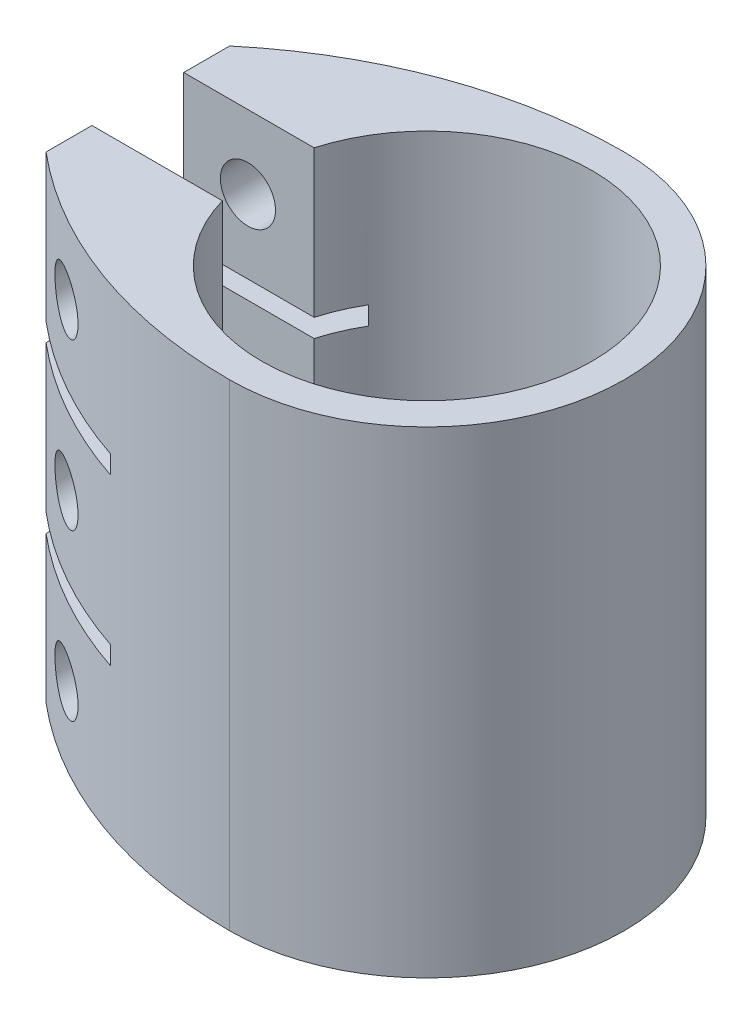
SolidWorks part; units mm, degrees
ref_plane "Alzado" through (0, 0, 0) normal (0, 0, 1) x (1, 0, 0)
ref_plane "Planta" through (0, 0, 0) normal (0, 1, 0) x (1, 0, 0)
ref_plane "Vista lateral" through (0, 0, 0) normal (1, 0, 0) x (0, 0, -1)
sketch "Croquis1" plane through (0, 0, 0) normal (0, 1, 0) x (1, 0, 0)
  line L0 (0, 21.5) -> (46.284, 21.5) construction
  line L1 (-31.5, 10) -> (-31.5, 5)
  line L2 (-31.5, 5) -> (-17.2916, 5)
  line L3 (0, 0) -> (-31.5, 0) construction
  line L4 (-31.5, 0) -> (-31.5, 5) construction
  line L5 (-31.5, -10) -> (-31.5, -5)
  line L6 (-31.5, -5) -> (-17.2916, -5)
  arc A0 (-17.2916, -5) -> (-17.2916, 5) centre (0, 0) ccw
  arc A1 (0, -21.5) -> (0, 21.5) centre (0, 0) ccw
  arc A2 (0, 21.5) -> (-31.5, 10) centre (0, -27.3913) ccw
  arc A3 (0, -21.5) -> (-31.5, -10) centre (0, 27.3913) cw
  point P11 (21.5, 0)
  dimension "D1" = 43
  dimension "D2" = 36
  dimension "D3" = 53
  dimension "D4" = 5
  dimension "D5" = 5
extrude "Saliente-Extruir1" add sketch "Croquis1" along normal blind 52
sketch "Croquis2" plane through (0, 0, 0) normal (0, 0, 1) x (1, 0, 0)
  line L0 (-31.5, 52) -> (-31.5, 0) construction
  line L1 (-31.5, 18) -> (-15.5, 18)
  line L2 (-31.5, 18) -> (-31.5, 16)
  line L3 (-31.5, 16) -> (-15.5, 16)
  line L4 (-15.5, 18) -> (-15.5, 16)
  line L5 (-31.5, 0) -> (0, 0) construction
  line L6 (-31.5, 36) -> (-15.5, 36)
  line L7 (-31.5, 36) -> (-31.5, 34)
  line L8 (-31.5, 34) -> (-15.5, 34)
  line L9 (-15.5, 36) -> (-15.5, 34)
  line L10 (0, 52) -> (-31.5, 52) construction
  dimension "D1" = 2
  dimension "D2" = 2
  dimension "D3" = 16
  dimension "D4" = 16
  dimension "D5" = 16
extrude "Cortar-Extruir1" cut sketch "Croquis2" against normal blind 52 and the other way blind 52
sketch "Croquis3" plane through (0, 0, -5) normal (0, 0, 1) x (1, 0, 0)
  line L0 (-31.5, 44) -> (-24.5, 44) construction
  line L1 (-31.5, 52) -> (-31.5, 36) construction
  line L3 (-31.5, 34) -> (-31.5, 18) construction
  line L4 (-31.5, 26) -> (-24.5, 26) construction
  line L6 (-31.5, 16) -> (-31.5, 0) construction
  line L7 (-31.5, 8) -> (-24.5, 8) construction
  line L8 (-24.5, 8) -> (-24.5, 44) construction
  circle A0 centre (-24.5, 44) radius 3
  circle A1 centre (-24.5, 26) radius 3
  circle A2 centre (-24.5, 8) radius 3
  dimension "D2" = 6
  dimension "D3" = 6
  dimension "D4" = 6
  dimension "D1" = 7
extrude "Cortar-Extruir2" cut sketch "Croquis3" against normal blind 52 and the other way blind 52
